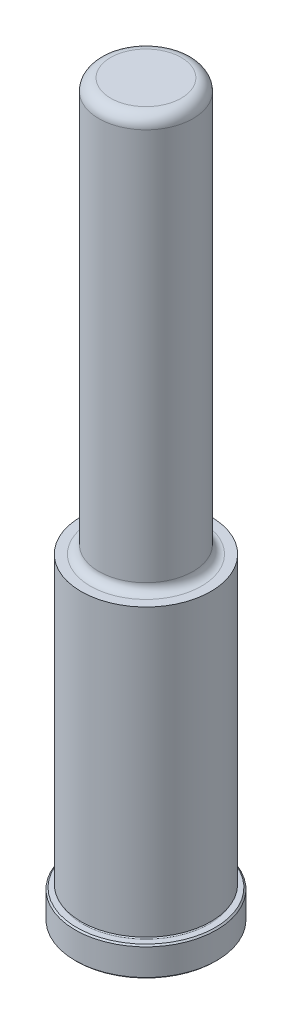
SolidWorks part; units mm, degrees
ref_plane "Front Plane" through (0, 0, 0) normal (0, 0, 1) x (1, 0, 0)
ref_plane "Top Plane" through (0, 0, 0) normal (0, 1, 0) x (1, 0, 0)
ref_plane "Right Plane" through (0, 0, 0) normal (1, 0, 0) x (0, 0, -1)
sketch "Sketch1" plane through (0, 0, 0) normal (1, 0, 0) x (0, 0, -1)
  line L0 (0, 0) -> (19.05, 0)
  line L1 (19.05, 0) -> (19.05, 7.9248)
  line L2 (19.05, 7.9248) -> (17.0688, 7.9248)
  line L3 (16.6878, 2.6782) -> (16.6878, 5.9795) construction
  line L4 (17.0688, 8.6868) -> (17.4752, 8.6868)
  line L5 (17.4752, 8.6868) -> (17.4752, 85.725)
  line L6 (17.4752, 85.725) -> (14.9733, 85.725)
  line L7 (12.6873, 88.011) -> (12.6873, 196.85)
  line L9 (12.6873, 196.85) -> (0, 196.85)
  line L10 (0, 196.85) -> (0, 0)
  line L11 (0, 0) -> (0, -7.2694) construction
  arc A0 (17.0688, 8.6868) -> (17.0688, 7.9248) centre (17.0688, 8.3058) ccw
  arc A1 (14.9733, 85.725) -> (12.6873, 88.011) centre (14.9733, 88.011) cw
  point P2 (12.6873, 196.85)
  point P14 (12.6873, 196.593)
  point P19 (12.6873, 85.725)
  dimension "D14" = 0.762
  dimension "D8" = 2.286
  dimension "T" = 7.9248
  dimension "D2" = 0.762
  dimension "M" = 38.1
  dimension "B" = 34.9504
  dimension "L" = 196.85
  dimension "D7" = 0.7874
  dimension "A" = 85.725
  dimension "D" = 25.3746
  dimension "D15" = 111.125
revolve "Revolve1" add sketch "Sketch1" angle 360 about L11
chamfer "Chamfer1" distance 0.381 angle 45 2 edges at (0, 0, 19.05) (0, 7.9248, 19.05)
fillet "Fillet7" radius 3.175 1 edges at (0, 196.85, 12.6873)
